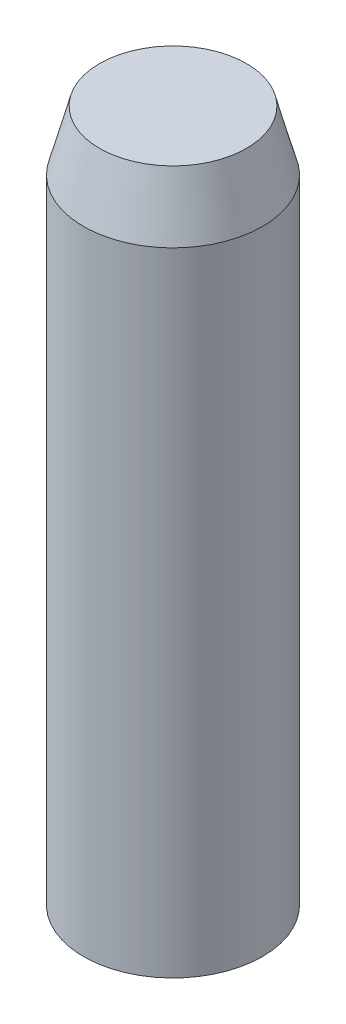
SolidWorks part; units mm, degrees
ref_plane "Face" through (0, 0, 0) normal (0, 0, 1) x (1, 0, 0)
ref_plane "Dessus" through (0, 0, 0) normal (0, 1, 0) x (1, 0, 0)
ref_plane "Cote" through (0, 0, 0) normal (1, 0, 0) x (0, 0, -1)
sketch "Esquisse3" plane through (0, 0, 0) normal (0, 0, 1) x (1, 0, 0)
  line L1 (0, 16) -> (0, 0)
  line L2 (2, 14.6667) -> (1.6427, 16)
  line L3 (2, 14.6667) -> (2, 0.5359)
  line L4 (0, 16) -> (0, 0) construction
  line L5 (0, 16) -> (1.6427, 16)
  arc A0 (2, 0.5359) -> (0, 0) centre (0, 4) cw
  dimension "R" = 4
  dimension "D1" = 15
  dimension "D" = 4
  dimension "L" = 16
  dimension "A" = 1.3333
revolve "Base-Révolution" add sketch "Esquisse3" angle 360 about L1
